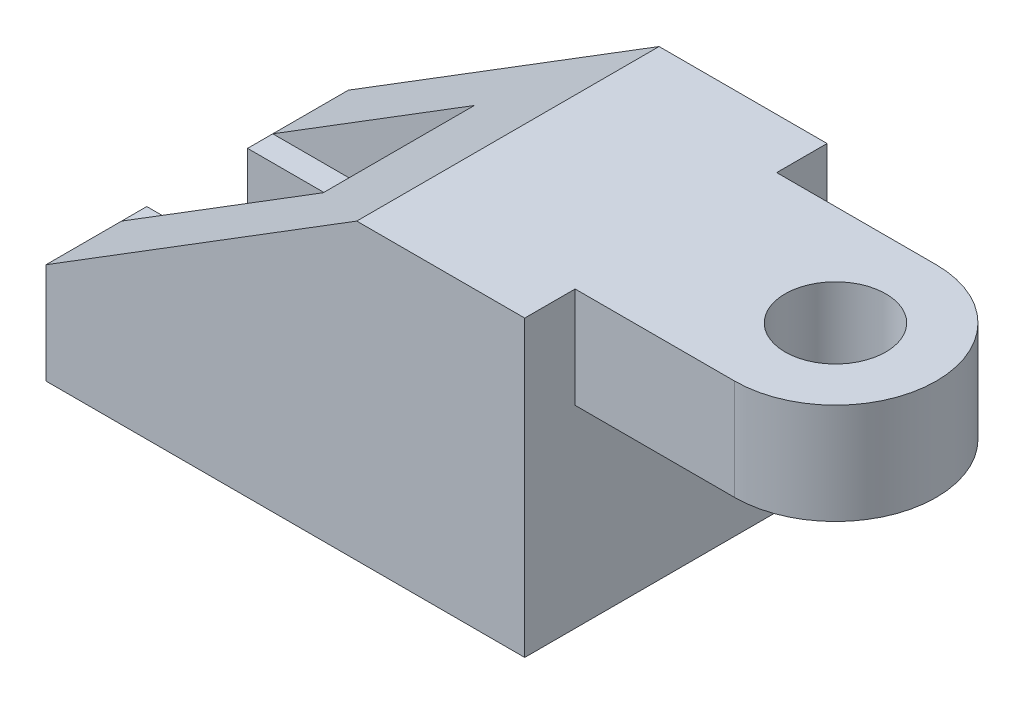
SolidWorks part; units mm, degrees
ref_plane "前视基准面" through (0, 0, 0) normal (0, 0, 1) x (1, 0, 0)
ref_plane "上视基准面" through (0, 0, 0) normal (0, 1, 0) x (1, 0, 0)
ref_plane "右视基准面" through (0, 0, 0) normal (1, 0, 0) x (0, 0, -1)
sketch "草图1" plane through (0, 0, 0) normal (0, 0, 1) x (1, 0, 0)
  line L0 (0, 0) -> (-57, 0)
  line L1 (-57, 0) -> (-57, 12)
  line L2 (-57, 12) -> (-20, 35)
  line L3 (-20, 35) -> (0, 35)
  line L4 (0, 35) -> (0, 0)
  dimension "D1" = 57
  dimension "D2" = 12
  dimension "D3" = 35
  dimension "D4" = 20
extrude "拉伸1" add sketch "草图1" along normal mid plane 36
sketch "草图2" plane through (0, 0, 0) normal (0, 0, 1) x (1, 0, 0)
  line L0 (-57, 12) -> (-33, 12)
  line L1 (-33, 12) -> (-33, 26.9189)
  line L2 (-20, 35) -> (-57, 12) construction
  line L3 (-33, 26.9189) -> (-57, 12)
extrude "切除-拉伸1" cut sketch "草图2" against normal mid plane 18
sketch "草图3" plane through (0, 12, 0) normal (0, 1, 0) x (1, 0, 0)
  line L0 (0, 0) -> (-59.4387, 0) construction
  line L1 (-57, 6) -> (-44, 6)
  line L2 (-57, 9) -> (-57, -9) construction
  line L3 (-44, -6) -> (-57, -6)
  line L4 (-57, -6) -> (-57, 6)
  arc A0 (-44, 6) -> (-44, -6) centre (-44, 0) cw
  dimension "D1" = 13
  dimension "D2" = 12
extrude "切除-拉伸2" cut sketch "草图3" against normal blind 18
sketch "草图4" plane through (0, 35, 0) normal (0, 1, 0) x (1, 0, 0)
  line L0 (0, 0) -> (27.2453, 0) construction
  line L1 (0, 12) -> (19, 12)
  line L2 (0, -18) -> (0, 18) construction
  line L3 (19, -12) -> (0, -12)
  line L4 (0, -12) -> (0, 12)
  arc A0 (19, 12) -> (19, -12) centre (19, 0) cw
  circle A1 centre (19, 0) radius 6
  dimension "D2" = 12
  dimension "D3" = 12
  dimension "D1" = 19
extrude "拉伸2" add sketch "草图4" against normal blind 12
